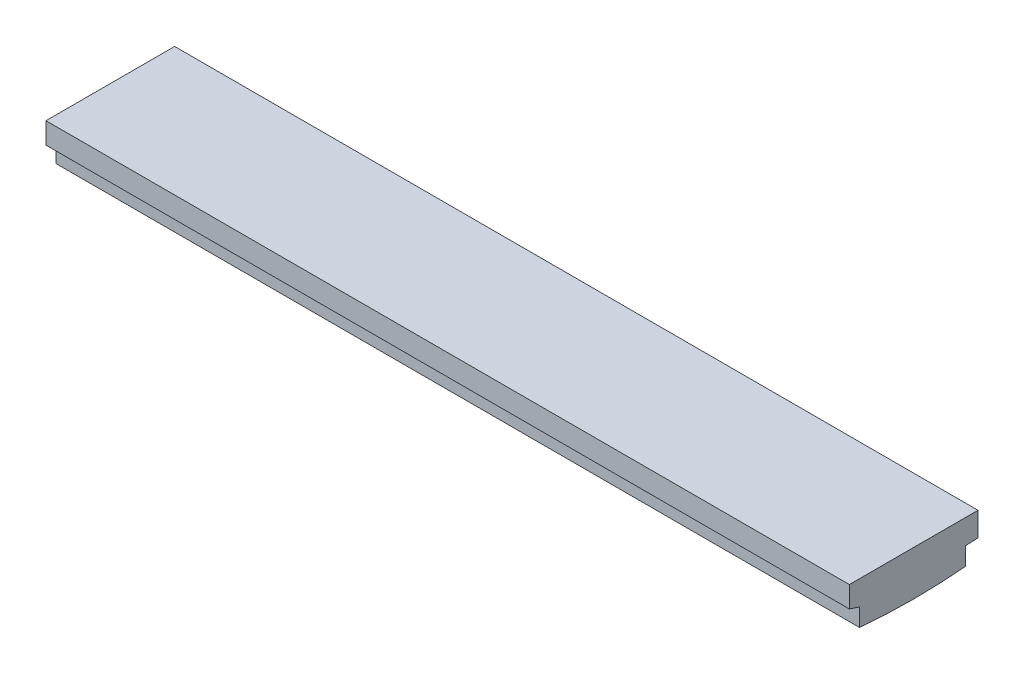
SolidWorks part; units mm, degrees
ref_plane "Front Plane" through (0, 0, 0) normal (0, 0, 1) x (1, 0, 0)
ref_plane "Top Plane" through (0, 0, 0) normal (0, 1, 0) x (1, 0, 0)
ref_plane "Right Plane" through (0, 0, 0) normal (1, 0, 0) x (0, 0, -1)
sketch "Sketch1" plane through (0, 0, 0) normal (1, 0, 0) x (0, 0, -1)
  line L0 (-6, 2.025) -> (6, -2.025) construction
  line L1 (-6, 2.025) -> (6, 2.025)
  line L2 (-6, 2.025) -> (-6, -2.025)
  line L3 (-6, -2.025) -> (6, -2.025)
  line L4 (6, 2.025) -> (6, -2.025)
  dimension "D1" = 12
  dimension "D2" = 4.05
extrude "Extrude1" add sketch "Sketch1" along normal mid plane 91
sketch "Sketch2" plane through (0, 0, 0) normal (1, 0, 0) x (0, 0, -1)
  line L2 (-8.3083, 2.775) -> (7.4105, 2.775)
  line L3 (-8.3083, 2.775) -> (-6, 2.025)
  line L4 (-6, 2.025) -> (6, 2.025)
  line L5 (6, 2.025) -> (7.4105, 2.775)
  dimension "D1" = 0.75
  dimension "D2" = 28
  dimension "D3" = 18
extrude "Extrude2" add sketch "Sketch2" along normal mid plane 91
sketch "Sketch3" plane through (45.5, 0, 0) normal (1, 0, 0) x (0, 0, -1)
  line L0 (-8.3083, 2.775) -> (-6.9292, 2.3269)
  line L1 (-8.3083, 2.775) -> (-6, 2.025) construction
  line L2 (-6.9292, 2.3269) -> (-7.1583, 2.775)
  line L3 (7.4105, 2.775) -> (-8.3083, 2.775) construction
  line L4 (-7.1583, 2.775) -> (-8.3083, 2.775)
  dimension "D1" = 1.15
  dimension "D2" = 1.45
extrude "Cut-Extrude1" cut sketch "Sketch3" against normal through all
sketch "Sketch4" plane through (45.5, 0, 0) normal (1, 0, 0) x (0, 0, -1)
  line L0 (-6, -2.025) -> (6, -2.025)
  arc A0 (6, -2.025) -> (-6, -2.025) centre (0, 65.2078) cw
  dimension "D1" = 67.5
extrude "Extrude3" add sketch "Sketch4" against normal blind 91
sketch "Sketch5" plane through (45.5, 0, 0) normal (1, 0, 0) x (0, 0, -1)
  line L0 (7.4105, 2.775) -> (6, 2.025)
  line L1 (6, 2.025) -> (6, 0)
  line L2 (6, -2.025) -> (6, 2.025) construction
  line L3 (7.4105, 2.775) -> (7.4105, 0.0628)
  line L4 (7.4105, 0.0628) -> (6, 0)
  line L5 (-6, 2.025) -> (-7.1583, 2.775)
  line L6 (-6, 2.025) -> (-6, 0)
  line L7 (-6, 2.025) -> (-6, -2.025) construction
  line L8 (-7.1583, 2.775) -> (-7.1583, 0.3763)
  line L9 (-7.1583, 0.3763) -> (-6, 0)
  line L10 (-6.9292, 2.3269) -> (-6, 2.025) construction
  dimension "D1" = 2.7122
extrude "Extrude4" add sketch "Sketch5" against normal blind 91
